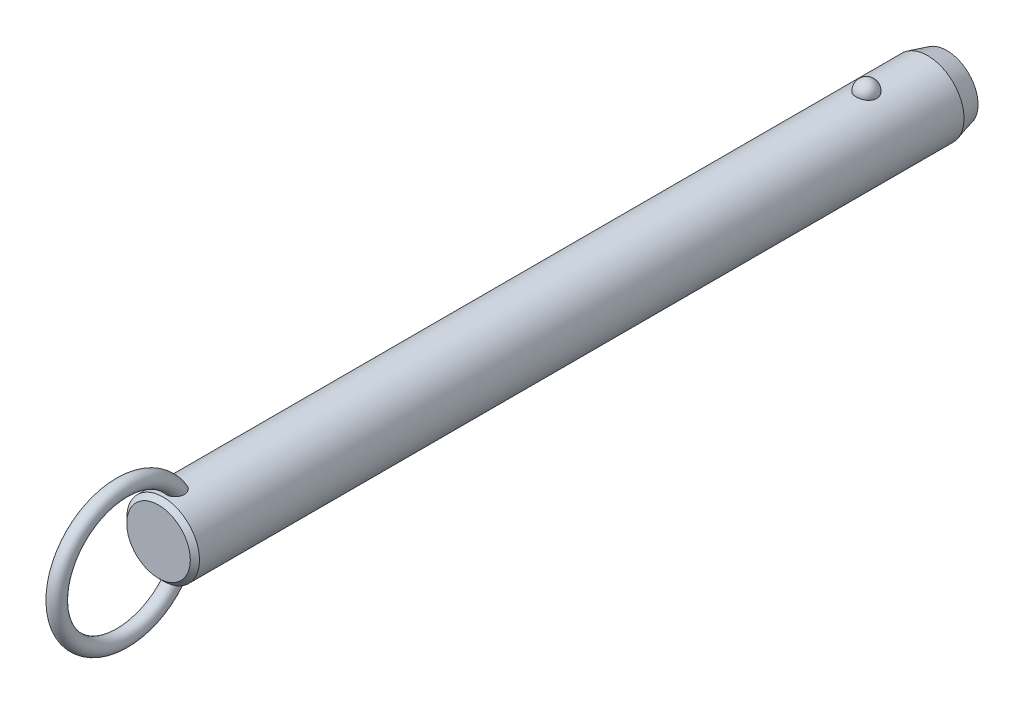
SolidWorks part; units mm, degrees
ref_plane "Front Plane" through (0, 0, 0) normal (0, 0, 1) x (1, 0, 0)
ref_plane "Top Plane" through (0, 0, 0) normal (0, 1, 0) x (1, 0, 0)
ref_plane "Right Plane" through (0, 0, 0) normal (1, 0, 0) x (0, 0, -1)
sketch "Sketch2" plane through (0, 0, 0) normal (0, 0, 1) x (1, 0, 0)
  circle A0 centre (0, 0) radius 9.5
  point P3 (0, 9.5)
  dimension "D1" = 19
extrude "Boss-Extrude1" add sketch "Sketch2" along normal blind 172.7
sketch "Sketch3" plane through (0, 0, 0) normal (0, 0, -1) x (-1, 0, 0)
  circle A0 centre (0, 0) radius 9.5
  dimension "D1" = 19
extrude "Boss-Extrude2" add sketch "Sketch3" along normal blind 23.7
chamfer "Chamfer1" distance 5 angle 15 1 edges at (-9.5, 0, -23.7)
sketch "Sketch12" plane through (0, 0, 0) normal (1, 0, 0) x (0, 0, -1)
  line L0 (-172.7, 9.5) -> (-172.7, -9.5) construction
  point P0 (-172.7, 0)
sketch "Sketch13" plane through (0, 0, 0) normal (1, 0, 0) x (0, 0, -1)
  circle A0 centre (-191.75, 0) radius 19.05
  point P2 (-172.7, 0)
  dimension "D1" = 38.1
sketch "Sketch14" plane through (0, 0, 0) normal (0, 1, 0) x (1, 0, 0)
  circle A0 centre (0, -174.7) radius 2
  point P2 (0, -172.7)
  dimension "D1" = 4
sweep "Sweep1" add profiles "Sketch14" path "Sketch13"
sketch "Sketch15" plane through (0, 0, 172.7) normal (0, 0, 1) x (1, 0, 0)
  circle A0 centre (0, 0) radius 9.5
  dimension "D1" = 19
extrude "Boss-Extrude3" add sketch "Sketch15" along normal blind 9.52
chamfer "Chamfer2" distance 1.2 angle 45 1 edges at (9.5, 0, 182.22)
sketch "Sketch18" plane through (0, 0, 0) normal (1, 0, 0) x (0, 0, -1)
  line L0 (18.7, 9.5) -> (-175.2378, 9.5) construction
  line L1 (2.7, 12.2) -> (2.7, 6.8)
  line L2 (-175.2378, -9.5) -> (18.7, -9.5) construction
  arc A0 (2.7, 12.2) -> (2.7, 6.8) centre (2.7, 9.5) ccw
  point P4 (0, 9.5)
  dimension "D1" = 21.7
revolve "Revolve1" add sketch "Sketch18" angle 360 about L1
